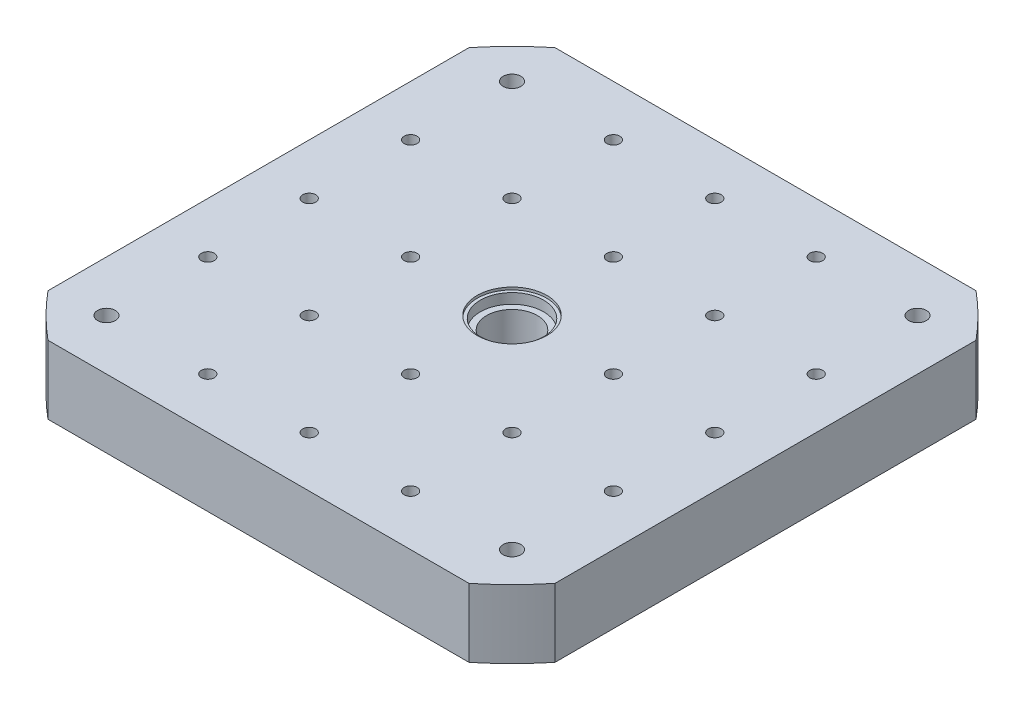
SolidWorks part; units mm, degrees
ref_plane "Face" through (0, 0, 0) normal (0, 0, 1) x (1, 0, 0)
ref_plane "Dessus" through (0, 0, 0) normal (0, 1, 0) x (1, 0, 0)
ref_plane "Droite" through (0, 0, 0) normal (1, 0, 0) x (0, 0, -1)
sketch "Esquisse1" plane through (0, 0, 0) normal (0, 1, 0) x (1, 0, 0)
  line L0 (0, 200) -> (0, -200) construction
  line L1 (-166.1325, 200) -> (166.1325, 200)
  line L2 (-200, 166.1325) -> (-200, -166.1325)
  line L3 (-166.1325, -200) -> (166.1325, -200)
  line L4 (200, 166.1325) -> (200, -166.1325)
  line L5 (-200, 0) -> (200, 0) construction
  arc A0 (166.1325, -200) -> (200, -166.1325) centre (0, 0) ccw
  arc A1 (200, 166.1325) -> (166.1325, 200) centre (0, 0) ccw
  arc A2 (-166.1325, 200) -> (-200, 166.1325) centre (0, 0) ccw
  arc A3 (-200, -166.1325) -> (-166.1325, -200) centre (0, 0) ccw
  dimension "D1" = 520
  dimension "D2" = 200
  dimension "D3" = 200
  dimension "D4" = 200
  dimension "D5" = 200
extrude "volume table" add sketch "Esquisse1" against normal blind 54
sketch "Esquisse3" plane through (0, 0, 0) normal (0, 1, 0) x (-1, 0, 0)
  line L1 (7, 200) -> (-7, 200)
  line L2 (7, 200) -> (7, -200)
  line L3 (7, -200) -> (-7, -200)
  line L4 (-7, 200) -> (-7, -200)
  dimension "D1" = 14
extrude "rainure 14" [suppressed] cut sketch "Esquisse3" against normal blind 5
sketch "Esquisse4" plane through (0, 0, 0) normal (0, 1, 0) x (-1, 0, 0)
  circle A0 centre (0, 0) radius 25
  dimension "D1" = 50
extrude "alésage ø20" cut sketch "Esquisse4" against normal blind 10
sketch "Esquisse10" plane through (0, 0, 0) normal (0, 1, 0) x (1, 0, 0)
  circle A0 centre (0, 0) radius 27.5
  dimension "D1" = 55
extrude "Enlèv. mat.-Extru.1" cut sketch "Esquisse10" against normal blind 2
hole_wizard "Trou taraudé M121" positions "Esquisse3D1" profile "Esquisse5" tap size "M12" standard "ISO"
sketch3d "Esquisse3D1"
  line L0 (0, 0, -200) -> (0, 0, 200) construction
  line L1 (-200, 0, 0) -> (200, 0, 0) construction
  point P0 (160, 0, 160)
  dimension "D1" = 160
  dimension "D2" = 160
sketch "Esquisse5" plane through (160, 0, 160) normal (1, 0, 0) x (0, 0, 1)
  line L0 (0, 0) -> (0, 32.3144)
  line L1 (0, 32.3144) -> (5.1, 29.25)
  line L2 (5.1, 29.25) -> (5.1, 0)
  line L5 (5.1, 0) -> (0, 0)
  line L10 (0, 32.3144) -> (-5.1, 29.25) construction
  line L11 (0, -6.35) -> (0, 107.95) construction
  dimension "Diamètre du trou pour taraudage" = 10.2
  dimension "Profondeur du trou pour taraudage" = 29.25
  dimension "Angle de pointe" = 118
pattern_linear "Répétition linéaire1" count 5 spacing 80 along (0, 0, -1) count 5 spacing 80 along (-1, 0, 0) of "Trou taraudé M121"
sketch "Esquisse6" plane through (0, 0, 200) normal (0, 0, 1) x (1, 0, 0)
  text T0 "Position B 0°"
sketch "Esquisse7" plane through (0, 0, -200) normal (0, 0, -1) x (-1, 0, 0)
  text T0 "Position B 180°"
sketch "Esquisse8" plane through (200, 0, 0) normal (1, 0, 0) x (0, 0, -1)
  text T0 "Position B 90°"
sketch "Esquisse9" plane through (-200, 0, 0) normal (-1, 0, 0) x (0, 0, 1)
  text T0 "Position B 270°"
sketch "Esquisse11" plane through (0, 0, 0) normal (0, 0, 1) x (1, 0, 0)
  line L0 (-166.1325, 0) -> (166.1325, 0) construction
  line L1 (-42.5, 0) -> (-37.5, 0)
  line L2 (-42.5, 0) -> (-42.5, -1)
  line L3 (-42.5, -1) -> (-37.5, -1)
  line L4 (-37.5, 0) -> (-37.5, -1)
  line L5 (-40, -1) -> (-40, 8.0576) construction
  line L6 (120, -1) -> (120, 18.3357) construction
  line L7 (37.5, 0) -> (42.5, 0)
  line L8 (37.5, 0) -> (37.5, -1)
  line L9 (37.5, -1) -> (42.5, -1)
  line L10 (42.5, 0) -> (42.5, -1)
  line L11 (-122.5, -1) -> (-117.5, -1)
  line L12 (-122.5, -1) -> (-122.5, 0)
  line L13 (-122.5, 0) -> (-117.5, 0)
  line L14 (-117.5, -1) -> (-117.5, 0)
  line L15 (117.5, -1) -> (122.5, -1)
  line L16 (117.5, -1) -> (117.5, 0)
  line L17 (117.5, 0) -> (122.5, 0)
  line L18 (122.5, -1) -> (122.5, 0)
  line L19 (40, -1) -> (40, 22.324) construction
  line L20 (-120, -1) -> (-120, 22.324) construction
  line L21 (200, 0) -> (200, 16.908) construction
  line L22 (197.5, 0) -> (202.5, 0)
  line L23 (197.5, 0) -> (197.5, -1)
  line L24 (197.5, -1) -> (202.5, -1)
  line L25 (202.5, 0) -> (202.5, -1)
  line L26 (-202.5, -1) -> (-197.5, -1)
  line L27 (-202.5, -1) -> (-202.5, 0)
  line L28 (-202.5, 0) -> (-197.5, 0)
  line L29 (-197.5, -1) -> (-197.5, 0)
  line L30 (200, 0) -> (166.1325, 0) construction
  line L31 (-200, -1) -> (-200, 52.1303) construction
  line L32 (-166.1325, 0) -> (-200, 0) construction
  dimension "D1" = 5
  dimension "D2" = 40
  dimension "D3" = 1
  dimension "D4" = 40
  dimension "D5" = 80
  dimension "D6" = 80
  dimension "D7" = 80
  dimension "D8" = 80
extrude "Enlèv. mat.-Extru.2" [suppressed] cut sketch "Esquisse11" against normal up to next and the other way up to next
sketch "Esquisse12" plane through (0, -10, 0) normal (0, 1, 0) x (1, 0, 0)
  circle A0 centre (0, 0) radius 20
  dimension "D1" = 40
extrude "Enlèv. mat.-Extru.3" cut sketch "Esquisse12" against normal up to next
sketch "Esquisse13" plane through (0, 0, 0) normal (0, 1, 0) x (1, 0, 0)
  circle A0 centre (0, -160) radius 10
  dimension "D1" = 20
extrude "Enlèv. mat.-Extru.4" [suppressed] cut sketch "Esquisse13" against normal blind 10
sketch "Esquisse14" plane through (0, 0, 0) normal (0, 1, 0) x (1, 0, 0)
  circle A0 centre (0, -160) radius 12
  dimension "D1" = 24
extrude "Enlèv. mat.-Extru.5" [suppressed] cut sketch "Esquisse14" against normal blind 2
hole_wizard "Trou taraudé M161" positions "Esquisse16" profile "Esquisse15" tap size "M16" standard "ISO"
sketch "Esquisse16" plane through (0, 0, 0) normal (0, 1, 0) x (-1, 0, 0)
  point P0 (-160, 160)
  point P1 (-160, -160)
  point P3 (160, 160)
  point P5 (160, -160)
sketch "Esquisse15" plane through (160, 0, 160) normal (1, 0, 0) x (0, 0, 1)
  line L0 (0, 0) -> (0, 42.206)
  line L1 (0, 42.206) -> (7, 38)
  line L2 (7, 38) -> (7, 0)
  line L5 (7, 0) -> (0, 0)
  line L10 (0, 42.206) -> (-7, 38) construction
  line L11 (0, -6.35) -> (0, 107.95) construction
  dimension "Diamètre du trou pour taraudage" = 14
  dimension "Profondeur du trou pour taraudage" = 38
  dimension "Angle de pointe" = 118
